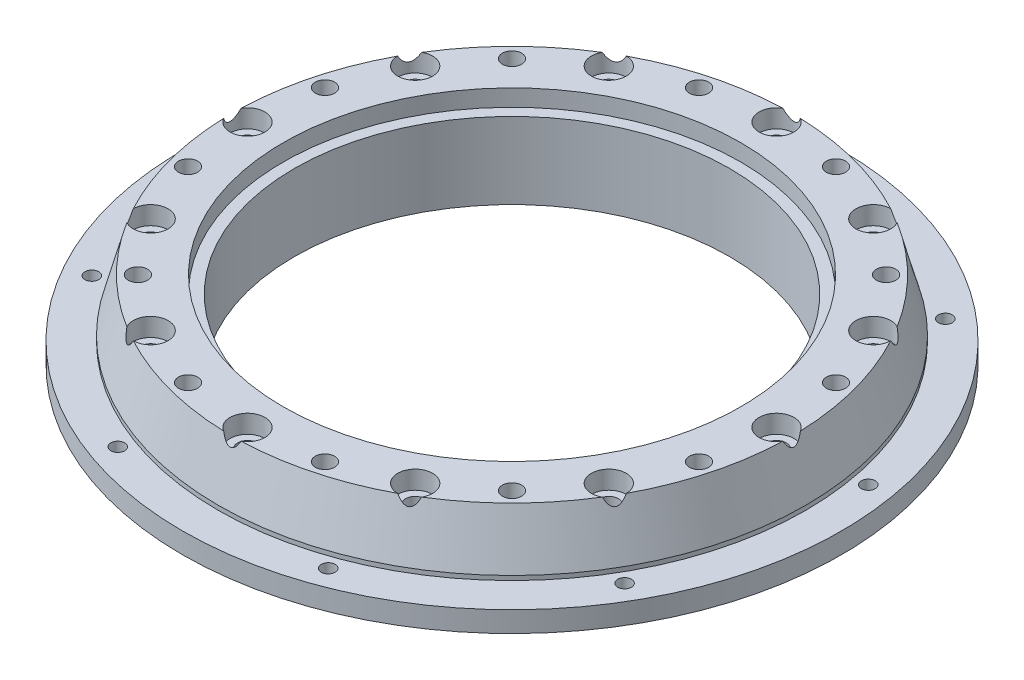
SolidWorks part; units mm, degrees
ref_plane "Front Plane" through (0, 0, 0) normal (0, 0, 1) x (1, 0, 0)
ref_plane "Top Plane" through (0, 0, 0) normal (0, 1, 0) x (1, 0, 0)
ref_plane "Right Plane" through (0, 0, 0) normal (1, 0, 0) x (0, 0, -1)
sketch "Sketch1" plane through (0, 0, 0) normal (0, 1, 0) x (1, 0, 0)
  circle A0 centre (0, 0) radius 75
  dimension "D1" = 150
extrude "Boss-Extrude1" add sketch "Sketch1" along normal blind 21.2
sketch "Sketch2" plane through (0, 21.2, 0) normal (0, 1, 0) x (1, 0, 0)
  circle A0 centre (0, 0) radius 49.53
  dimension "D1" = 99.06
extrude "Cut-Extrude1" cut sketch "Sketch2" against normal through all
sketch "Sketch3" plane through (0, 21.2, 0) normal (0, 1, 0) x (1, 0, 0)
  circle A0 centre (0, 0) radius 66.875
  dimension "D1" = 133.75
extrude "Cut-Extrude2" cut sketch "Sketch3" against normal blind 12 flip side to cut
sketch "Sketch4" plane through (0, 9.2, 0) normal (0, 1, 0) x (1, 0, 0)
  circle A0 centre (0, 0) radius 66.875
draft "Draft5" type of draft neutral plane draft angle 15 faces to draft 1 parameters "D1"=15
extrude "Cut-Extrude4" cut sketch "Sketch4" against normal blind 1 flip side to cut
hole_wizard "Tapped Hole for M3x0.5 Helicoil2" positions "Sketch7" profile "Sketch8" tap size "M3x0.5" standard "Helicoil® Metric"
sketch "Sketch7" plane through (0, 21.2, 0) normal (0, 1, 0) x (1, 0, 0)
  point P0 (0, 70)
  dimension "D1" = 70
sketch "Sketch8" plane through (0, 21.2, -70) normal (1, 0, 0) x (0, 0, 1)
  line L0 (0, 0) -> (0, 21.2)
  line L1 (0, 21.2) -> (1.575, 21.2)
  line L2 (1.575, 21.2) -> (1.575, 0)
  line L5 (1.575, 0) -> (0, 0)
  line L11 (0, -6.35) -> (0, 107.95) construction
  dimension "Thru Tap Drill Dia." = 3.15
  dimension "Thru Tap Drill Depth" = 21.2
pattern_circular "CirPattern2" count 9 over 360 about axis through (0, 0, 0) along (0, 1, 0) of "Tapped Hole for M3x0.5 Helicoil2"
hole_wizard "CBORE for #8 Socket Head Cap Screw1" positions "Sketch9" profile "Sketch10" counterbore size "#8" standard "ANSI Inch"
sketch "Sketch9" plane through (0, 21.2, 0) normal (0, 1, 0) x (1, 0, 0)
  point P0 (0, 60.198)
  dimension "D1" = 60.198
sketch "Sketch10" plane through (0, 21.2, -60.198) normal (1, 0, 0) x (0, 0, 1)
  line L0 (0, 0) -> (0, 21.2)
  line L1 (0, 21.2) -> (2.2479, 21.2)
  line L3 (2.2479, 21.2) -> (2.2479, 4.1656)
  line L4 (2.2479, 4.1656) -> (3.9687, 4.1656)
  line L5 (3.9687, 4.1656) -> (3.9687, 0)
  line L7 (3.9687, 0) -> (0, 0)
  line L11 (0, -6.35) -> (0, 107.95) construction
  dimension "Thru Hole Dia." = 4.4958
  dimension "Thru Hole Depth" = 21.2
  dimension "C'Bore Dia." = 7.9375
  dimension "C'Bore Depth" = 4.1656
pattern_circular "CirPattern3" count 12 over 360 about axis through (0, 0, 0) along (0, 1, 0) of "CBORE for #8 Socket Head Cap Screw1"
hole_wizard "Tapped Hole for #8-32 Helicoil1" positions "Sketch13" profile "Sketch14" tap size "#8-32" standard "Helicoil® Inch"
sketch "Sketch13" plane through (0, 21.2, 0) normal (0, 1, 0) x (1, 0, 0)
  line L0 (0, 60.198) -> (0, 0)
  line L1 (0, 0) -> (15.5804, 58.1468)
  point P0 (15.5804, 58.1468)
  dimension "D1" = 60.198
  dimension "D2" = 15
sketch "Sketch14" plane through (15.5804, 21.2, -58.1468) normal (1, 0, 0) x (0, 0, 1)
  line L0 (0, 0) -> (0, 21.2)
  line L1 (0, 21.2) -> (2.1971, 21.2)
  line L2 (2.1971, 21.2) -> (2.1971, 0)
  line L5 (2.1971, 0) -> (0, 0)
  line L11 (0, -6.35) -> (0, 107.95) construction
  dimension "Thru Tap Drill Dia." = 4.3942
  dimension "Thru Tap Drill Depth" = 21.2
pattern_circular "CirPattern4" count 12 over 360 about axis through (0, 0, 0) along (0, 1, 0) of "Tapped Hole for #8-32 Helicoil1"
sketch "Sketch15" plane through (0, 0, 0) normal (0, -1, 0) x (-1, 0, 0)
  circle A0 centre (0, 0) radius 52.07
  dimension "D1" = 104.14
extrude "Cut-Extrude5" cut sketch "Sketch15" against normal blind 3.5 flip side to cut
chamfer "Chamfer1" distance 1 angle 45 1 edges at (0, 0, -52.07)
sketch "Sketch18" plane through (0, 21.2, 0) normal (0, 1, 0) x (1, 0, 0)
  circle A0 centre (0, 0) radius 52.07
extrude "Cut-Extrude6" cut sketch "Sketch18" against normal blind 3.82
